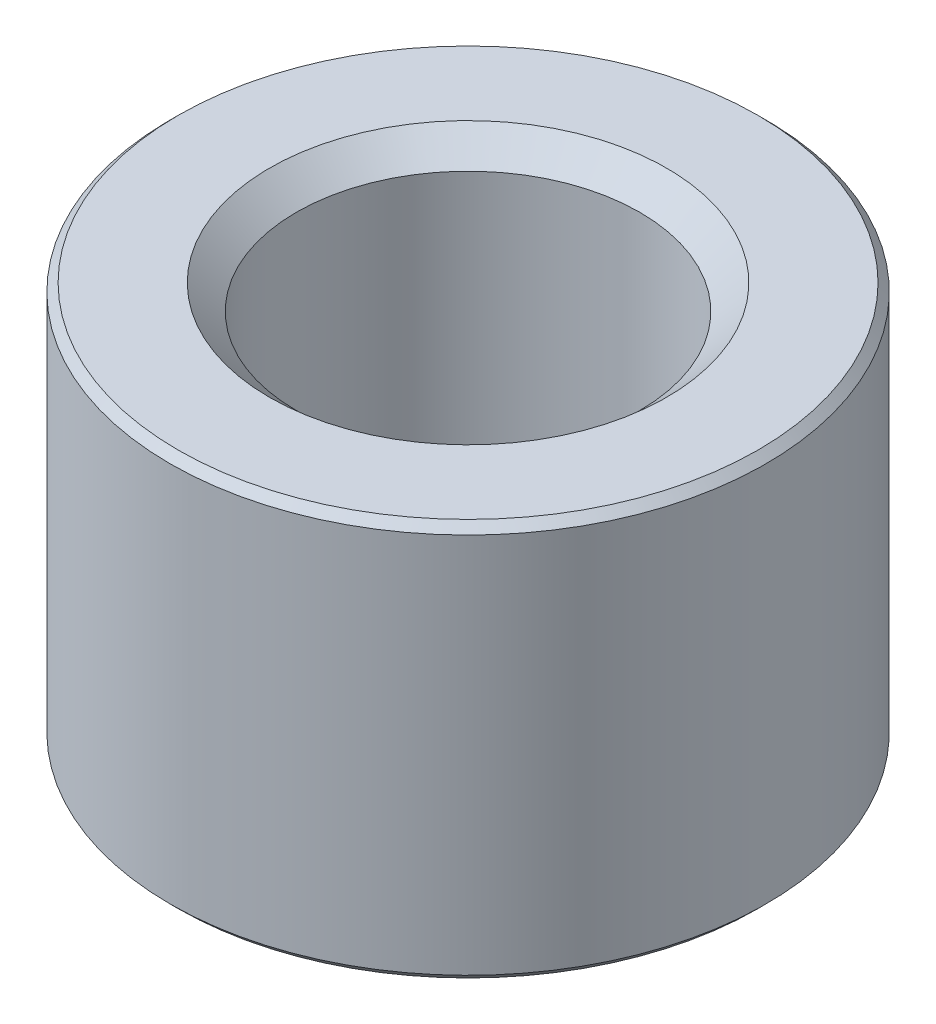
SolidWorks part; units mm, degrees
ref_plane "Plan de face" through (0, 0, 0) normal (0, 0, 1) x (1, 0, 0)
ref_plane "Plan de dessus" through (0, 0, 0) normal (0, 1, 0) x (1, 0, 0)
ref_plane "Plan de droite" through (0, 0, 0) normal (1, 0, 0) x (0, 0, -1)
ref_plane "Plan1" through (0, 0, 0) normal (0, 0, -1) x (-1, 0, 0)
sketch "Esquisse1" plane through (0, 0, 0) normal (0, 0, -1) x (-1, 0, 0)
  line L0 (-6, 0) -> (-5.1881, 0.75)
  line L1 (-5.1881, 0.75) -> (-5.1881, 11.25)
  line L2 (-5.1881, 11.25) -> (-6, 12)
  line L3 (-6, 12) -> (-8.76, 12)
  line L4 (-8.76, 12) -> (-9, 11.76)
  line L5 (-9, 11.76) -> (-9, 0.24)
  line L6 (-9, 0.24) -> (-8.76, 0)
  line L7 (-8.76, 0) -> (-6, 0)
  line L8 (0, 0) -> (0, 12) construction
  line L9 (-9, 6) -> (-5.1881, 6) construction
  dimension "D1" = 9
  dimension "D2" = 12
  dimension "D3" = 47.269
  dimension "D4" = 45
  dimension "D5" = 0.24
  dimension "D6" = 0.8119
  dimension "D7" = 5.1881
revolve "Révolution1" add sketch "Esquisse1" angle 360 about L8
